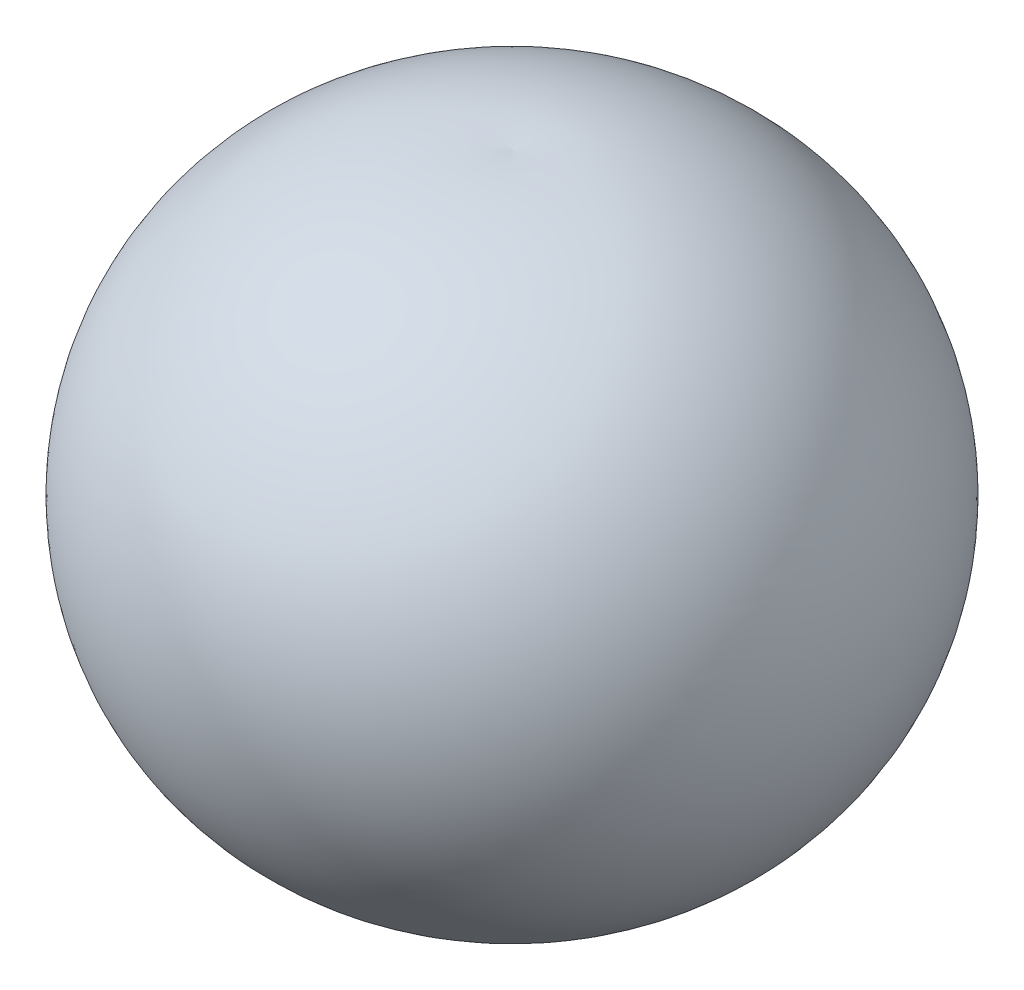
SolidWorks part; units mm, degrees
ref_plane "Front Plane" through (0, 0, 0) normal (0, 0, 1) x (1, 0, 0)
ref_plane "Top Plane" through (0, 0, 0) normal (0, 1, 0) x (1, 0, 0)
ref_plane "Right Plane" through (0, 0, 0) normal (1, 0, 0) x (0, 0, -1)
sketch "Sketch1" plane through (0, 0, 0) normal (0, 0, 1) x (1, 0, 0)
  line L0 (0, 45.6804) -> (0, -37.7779) construction
  line L1 (0, 7.8884) -> (0, -7.8884)
  arc A0 (0, 7.8884) -> (0, -7.8884) centre (0.7583, 0) cw
  dimension "D1" = 7.9248
revolve "Revolve1" add sketch "Sketch1" angle 360 about L0
